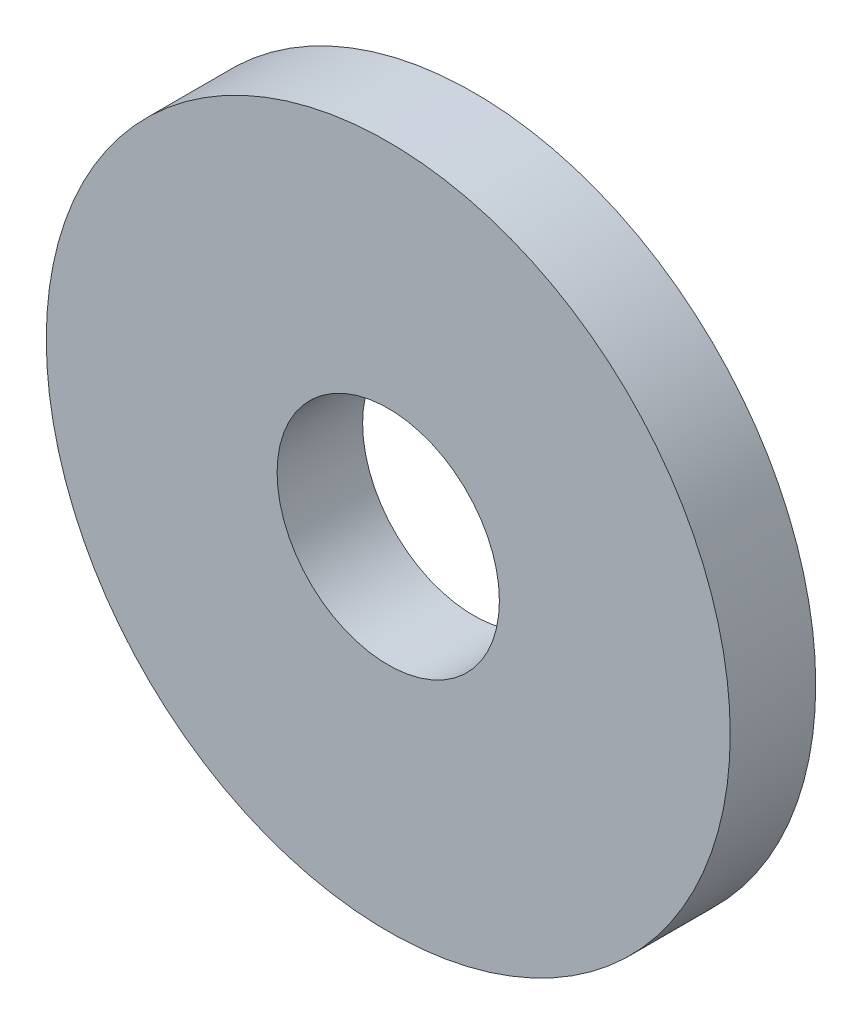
SolidWorks part; units mm, degrees
ref_plane "Front" through (0, 0, 0) normal (0, 0, 1) x (1, 0, 0)
ref_plane "Top" through (0, 0, 0) normal (0, 1, 0) x (1, 0, 0)
ref_plane "Right" through (0, 0, 0) normal (1, 0, 0) x (0, 0, -1)
sketch "Esquisse1" plane through (0, 0, 0) normal (0, 0, 1) x (1, 0, 0)
  circle A0 centre (0, 0) radius 20
  circle A1 centre (0, 0) radius 6.5
  dimension "D1" = 40
  dimension "D2" = 13
extrude "Base-Extrusion" add sketch "Esquisse1" along normal blind 5
